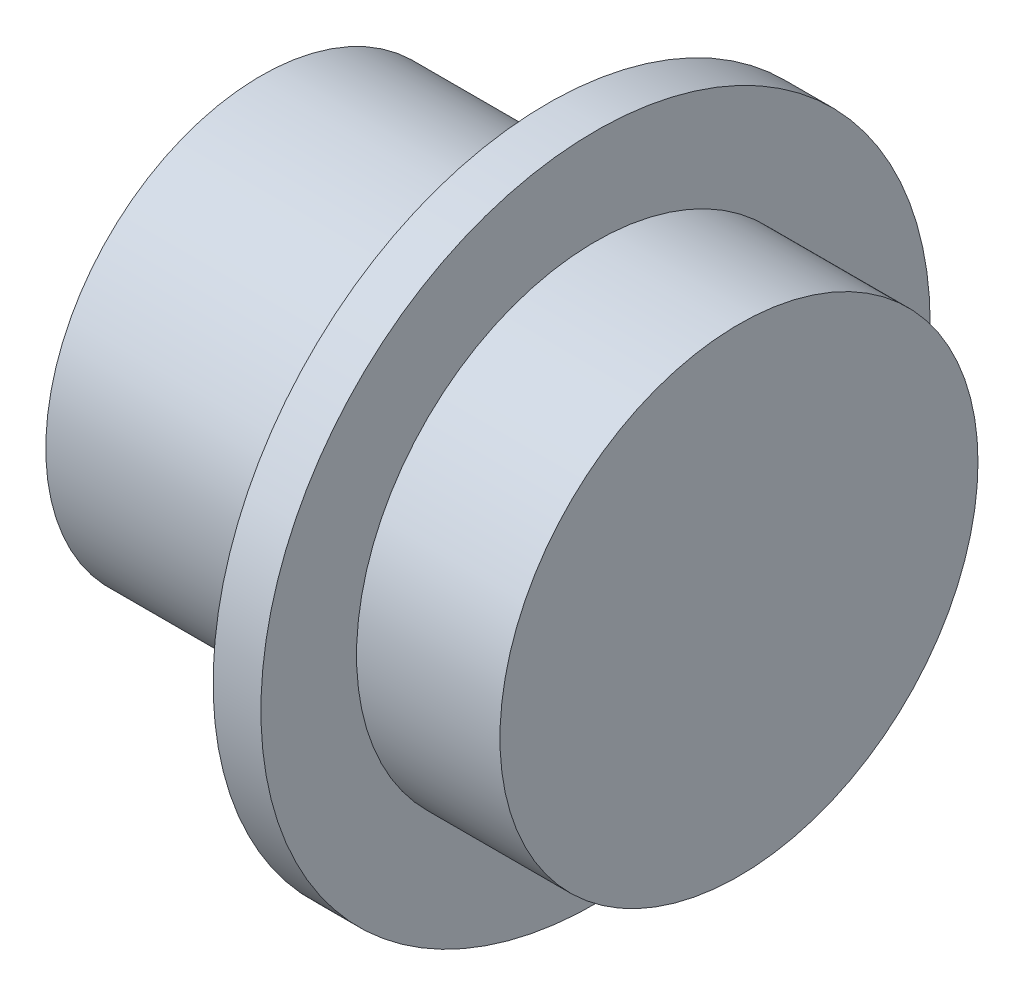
SolidWorks part; units mm, degrees
ref_plane "前视基准面" through (0, 0, 0) normal (0, 0, 1) x (1, 0, 0)
ref_plane "上视基准面" through (0, 0, 0) normal (0, 1, 0) x (1, 0, 0)
ref_plane "右视基准面" through (0, 0, 0) normal (1, 0, 0) x (0, 0, -1)
sketch "草图1" plane through (0, 0, 0) normal (0, 0, 1) x (1, 0, 0)
  line L0 (58, 18) -> (45.2367, 18) construction
  line L1 (58, 11) -> (58, 25) construction
  line L2 (51, 22.5) -> (57, 22.5)
  line L3 (57, 11) -> (57, 25) construction
  line L4 (57, 22.5) -> (57, 25)
  line L5 (57, 25) -> (58, 25)
  line L6 (58, 25) -> (58, 23)
  line L7 (58, 23) -> (61, 23)
  line L8 (61, 23) -> (61, 18)
  line L9 (51, 22.5) -> (51, 18)
  line L10 (51, 18) -> (61, 18)
  dimension "D1" = 7
  dimension "D2" = 4.5
  dimension "D3" = 7
  dimension "D4" = 5
  dimension "D5" = 10
revolve "旋转1" add sketch "草图1" angle 360 about L0
